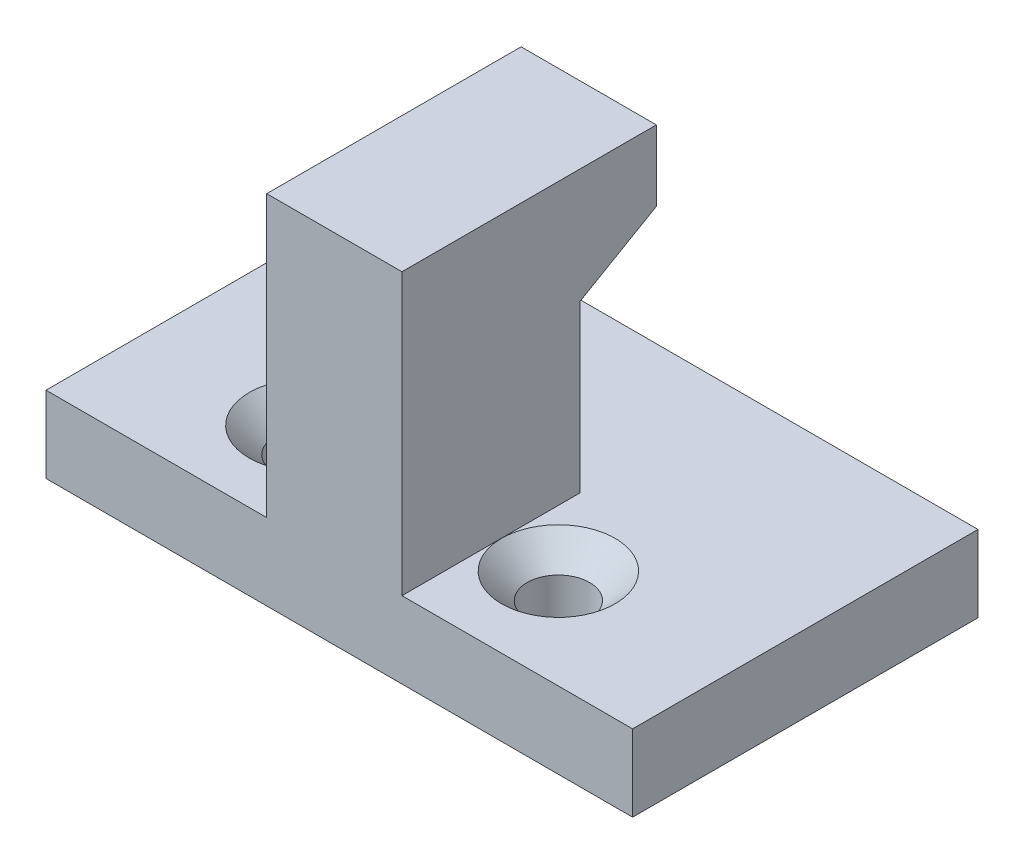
SolidWorks part; units mm, degrees
ref_plane "Спереди" through (0, 0, 0) normal (0, 0, 1) x (1, 0, 0)
ref_plane "Сверху" through (0, 0, 0) normal (0, 1, 0) x (1, 0, 0)
ref_plane "Справа" through (0, 0, 0) normal (1, 0, 0) x (0, 0, -1)
sketch "Эскиз1" plane through (0, 0, 0) normal (0, 1, 0) x (1, 0, 0)
  line L1 (-38.7766, 28.24) -> (-15.7766, 28.24)
  line L2 (-38.7766, 28.24) -> (-38.7766, 14.6977)
  line L3 (-38.7766, 14.6977) -> (-15.7766, 14.6977)
  line L4 (-15.7766, 28.24) -> (-15.7766, 14.6977)
  line L5 (-38.7636, 14.3253) -> (-15.7636, 14.3253)
  line L6 (-38.7636, 14.3253) -> (-38.7636, -15.6747)
  line L7 (-38.7636, -15.6747) -> (-15.7636, -15.6747)
  line L8 (-15.7636, 14.3253) -> (-15.7636, -15.6747)
  circle A0 centre (-22.5896, 0) radius 1.2251
  circle A1 centre (-32.4896, 0) radius 1.2251
  circle A2 centre (-22.5896, 18.6) radius 1.2251
  circle A3 centre (-32.4896, 18.6) radius 1.2251
  dimension "D1" = 9.9
  dimension "D2" = 18.6
  dimension "D3" = 18.6
  dimension "D4" = 30
  dimension "D5" = 23
  dimension "D6" = 23
extrude "Бобышка-Вытянуть1" add sketch "Эскиз1" along normal blind 3
chamfer "Фаска1" distance 1 angle 45 2 edges at (-22.5896, 3, -17.3749) (-32.4896, 3, -17.3749)
chamfer "Фаска2" distance 1 angle 45 2 edges at (-22.5896, 3, 1.2251) (-32.4896, 3, 1.2251)
sketch "Эскиз3" plane through (0, 3, 0) normal (0, 1, 0) x (1, 0, 0)
  line L0 (-38.7766, 14.6977) -> (-15.7766, 14.6977) construction
  line L1 (-24.8199, 14.6977) -> (-30.1221, 14.6977)
  line L2 (-24.8199, 14.6977) -> (-24.8199, 21.6712)
  line L3 (-24.8199, 21.6712) -> (-30.1221, 21.6712)
  line L4 (-30.1221, 14.6977) -> (-30.1221, 21.6712)
extrude "Бобышка-Вытянуть2" add sketch "Эскиз3" along normal blind 11
sketch "Эскиз4" plane through (0, 0, -21.6712) normal (0, 0, -1) x (-1, 0, 0)
  line L0 (30.1221, 14) -> (30.1221, 3) construction
  line L1 (24.8199, 14) -> (30.1221, 14)
  line L2 (24.8199, 14) -> (24.8199, 9.5)
  line L3 (24.8199, 9.5) -> (30.1221, 9.5)
  line L4 (30.1221, 14) -> (30.1221, 9.5)
  dimension "D1" = 4.5
extrude "Бобышка-Вытянуть3" add sketch "Эскиз4" along normal blind 3
draft "Уклон2" type of draft neutral plane draft angle 30 faces to draft 1 parameters "D1"=30
sketch "Эскиз5" plane through (0, 3, 0) normal (0, 1, 0) x (1, 0, 0)
  line L0 (-15.7636, 14.3253) -> (-38.7636, 14.3253) construction
  line L1 (-34.4485, 14.3253) -> (-20.2405, 14.3253)
  line L2 (-34.4485, 14.3253) -> (-34.4485, 2.9491)
  line L3 (-34.4485, 2.9491) -> (-20.2405, 2.9491)
  line L4 (-20.2405, 14.3253) -> (-20.2405, 2.9491)
extrude "Бобышка-Вытянуть4" add sketch "Эскиз5" along normal blind 10
sketch "Эскиз6" plane through (-34.4485, 0, 0) normal (-1, 0, 0) x (0, 0, 1)
  circle A0 centre (-8.9626, 10.7326) radius 0.7
extrude "Вырез-Вытянуть1" cut sketch "Эскиз6" against normal blind 26
sketch "Эскиз10" plane through (0, 0, -2.9491) normal (0, 0, 1) x (1, 0, 0)
  line L1 (-20.2405, 3) -> (-34.4485, 3)
  line L2 (-20.2405, 3) -> (-20.2405, 13)
  line L3 (-20.2405, 13) -> (-34.4485, 13)
  line L4 (-34.4485, 3) -> (-34.4485, 13)
extrude "Вырез-Вытянуть2" cut sketch "Эскиз10" against normal blind 3
delete or keep bodies "Тело-Удалить/Сохранить 1" type delete bodies bodies 106
